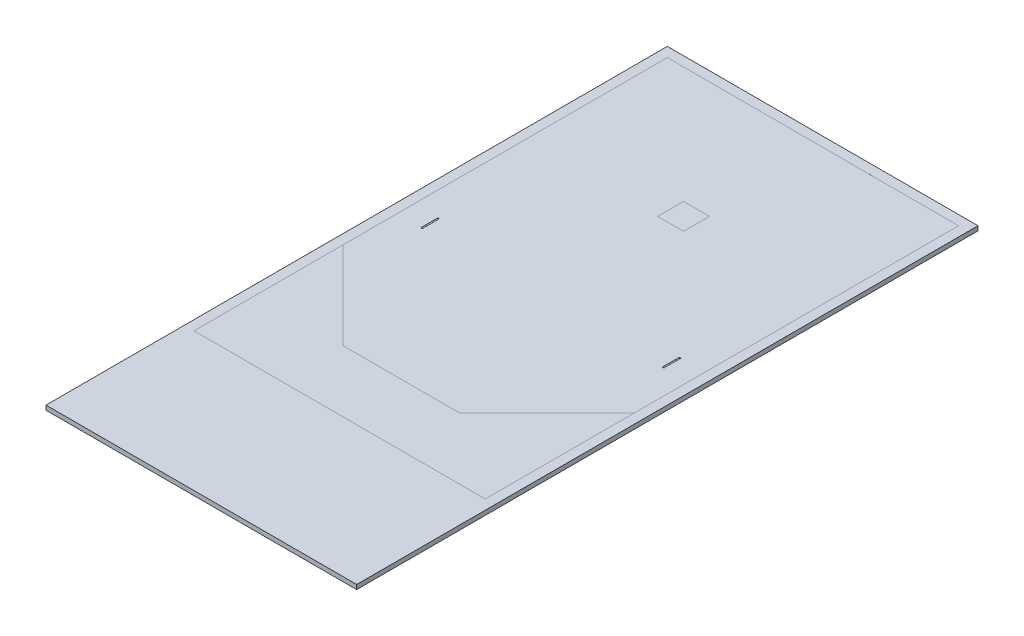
SolidWorks part; units mm, degrees
ref_plane "Front Plane" through (0, 0, 0) normal (0, 0, 1) x (1, 0, 0)
ref_plane "Top Plane" through (0, 0, 0) normal (0, 1, 0) x (1, 0, 0)
ref_plane "Right Plane" through (0, 0, 0) normal (1, 0, 0) x (0, 0, -1)
sketch "Sketch1" plane through (0, 0, 0) normal (0, 0, 1) x (1, 0, 0)
  line L1 (-609.6, -8.7312) -> (609.6, -8.7312)
  line L2 (-609.6, -8.7312) -> (-609.6, 8.7312)
  line L3 (-609.6, 8.7312) -> (609.6, 8.7312)
  line L4 (609.6, -8.7312) -> (609.6, 8.7312)
  line L5 (-609.6, -8.7312) -> (609.6, 8.7312) construction
  line L6 (-609.6, 8.7312) -> (609.6, -8.7312) construction
  point P0 (0, 0)
  dimension "D1" = 17.4625
  dimension "D2" = 1219.2
extrude "Boss-Extrude1" add sketch "Sketch1" against normal blind 2438.4 contours L3 L4 L1 L2
sketch "Sketch2" plane through (0, 8.7312, 0) normal (0, 1, 0) x (1, 0, 0)
  line L0 (0, 0) -> (0, 2438.4) construction
  line L1 (-609.6, 2438.4) -> (609.6, 2438.4) construction
  line L3 (-571.5, 1524) -> (-368.3, 1524)
  line L4 (-571.5, 1524) -> (-571.5, 1270)
  line L5 (-571.5, 1270) -> (-368.3, 1270)
  line L6 (-368.3, 1524) -> (-368.3, 1270)
  line L7 (-609.6, 0) -> (609.6, 0) construction
  line L10 (-609.6, 2438.4) -> (-609.6, 0) construction
  line L11 (571.5, 1524) -> (368.3, 1524)
  line L12 (368.3, 1524) -> (368.3, 1270)
  line L13 (571.5, 1270) -> (368.3, 1270)
  line L14 (571.5, 1524) -> (571.5, 1270)
  point P13 (-609.6, 1219.2)
  dimension "D1" = 203.2
  dimension "D2" = 254
  dimension "D3" = 1270
  dimension "D4" = 38.1
extrude "Cut-Extrude1" [suppressed] cut sketch "Sketch2" against normal through all contours L14 L11 L12 L13 | L3 L6 L5 L4
sketch "Sketch5" plane through (0, 8.7312, 0) normal (0, 1, 0) x (1, 0, 0)
  line L0 (-571.5, 1127.7854) -> (-228.6, 784.8854)
  line L1 (-228.6, 784.8854) -> (228.6, 784.8854)
  line L2 (228.6, 784.8854) -> (571.5, 1127.7854)
  line L3 (571.5, 1127.7854) -> (571.5, 38.1)
  line L4 (571.5, 38.1) -> (-571.5, 38.1)
  line L5 (-571.5, 38.1) -> (-571.5, 1127.7854)
  line L6 (-609.6, 0) -> (609.6, 0) construction
  line L7 (-609.6, 2438.4) -> (-609.6, 0) construction
  line L8 (609.6, 2438.4) -> (609.6, 0) construction
  line L9 (-571.5, 542.925) -> (571.5, 542.925)
  dimension "D1" = 38.1
  dimension "D2" = 38.1
  dimension "D3" = 38.1
  dimension "D5" = 1127.7854
  dimension "D6" = 45
  dimension "D7" = 45
  dimension "D8" = 457.2
  dimension "D9" = 542.925
extrude "Cut-Extrude2" cut sketch "Sketch5" against normal blind 0.0003 contours L5 L9 L3 L2 L1 L0
sketch "Sketch6" plane through (0, 8.7312, 0) normal (0, 1, 0) x (1, 0, 0)
  line L0 (-571.5, 1127.7854) -> (-571.5, 2400.3)
  line L1 (-571.5, 2400.3) -> (571.5, 2400.3)
  line L2 (571.5, 2400.3) -> (571.5, 1127.7854)
  line L3 (-609.6, 2438.4) -> (609.6, 2438.4) construction
  line L6 (-571.5, 1127.7854) -> (-571.5, 542.925)
  line L7 (-571.5, 542.925) -> (571.5, 542.925)
  line L8 (571.5, 542.925) -> (571.5, 1127.7854)
  line L9 (571.5, 1127.7854) -> (228.6, 784.8854)
  line L10 (228.6, 784.8854) -> (-228.6, 784.8854)
  line L11 (-228.6, 784.8854) -> (-571.5, 1127.7854)
  line L12 (-571.5, 1127.7854) -> (-571.5, 542.925)
  line L13 (-571.5, 542.925) -> (571.5, 542.925)
  line L14 (571.5, 542.925) -> (571.5, 1127.7854)
  line L15 (571.5, 1127.7854) -> (228.6, 784.8854)
  line L16 (228.6, 784.8854) -> (-228.6, 784.8854)
  line L17 (-228.6, 784.8854) -> (-571.5, 1127.7854)
  dimension "D2" = 38.1
  dimension "D1" = 0
extrude "Cut-Extrude4" cut sketch "Sketch6" against normal blind 0.0005 contours L2 L1 L0 M13 M14 M15
sketch "Sketch7" plane through (0, 8.7307, 0) normal (0, 1, 0) x (1, 0, 0)
  line L0 (0, 0) -> (0, 2438.4) construction
  line L1 (50.8, 1841.5) -> (-50.8, 1841.5)
  line L2 (50.8, 1841.5) -> (50.8, 1943.1)
  line L3 (50.8, 1943.1) -> (-50.8, 1943.1)
  line L4 (-50.8, 1841.5) -> (-50.8, 1943.1)
  line L5 (50.8, 1841.5) -> (-50.8, 1943.1) construction
  line L6 (50.8, 1943.1) -> (-50.8, 1841.5) construction
  line L7 (-609.6, 0) -> (609.6, 0) construction
  line L8 (-609.6, 2438.4) -> (609.6, 2438.4) construction
  point P0 (0, 1892.3)
  dimension "D1" = 101.6
  dimension "D2" = 101.6
  dimension "D3" = 495.3
extrude "Boss-Extrude2" add sketch "Sketch7" along normal up to surface (0.0005 mm away)
ref_plane "Plane1" through (0, 0, -1371.6) normal (0, 0, -1) x (-1, 0, 0)
sketch "Sketch8" plane through (0, 0, -1371.6) normal (0, 0, -1) x (-1, 0, 0)
  line L4 (609.6, -8.7312) -> (609.6, 8.7312)
  line L5 (609.6, 8.7312) -> (-609.6, 8.7312)
  line L6 (-609.6, 8.7312) -> (-609.6, -8.7312)
  line L7 (-609.6, -8.7312) -> (609.6, -8.7312)
  line L8 (609.6, -8.7312) -> (609.6, 8.7312)
  line L9 (609.6, 8.7312) -> (-609.6, 8.7312)
  line L10 (-609.6, 8.7312) -> (-609.6, -8.7312)
  line L11 (-609.6, -8.7312) -> (609.6, -8.7312)
  circle A0 centre (-473.8624, 8.7312) radius 3.175
  dimension "D3" = 6.35
  dimension "D2" = 135.7376
  dimension "D1" = 0
extrude "Cut-Extrude5" cut sketch "Sketch8" against normal blind 33.3375 and the other way blind 33.3375 contours L9 A0
mirror "Mirror1" about plane through (0, 0, 0) normal (1, 0, 0) of "Cut-Extrude5"
